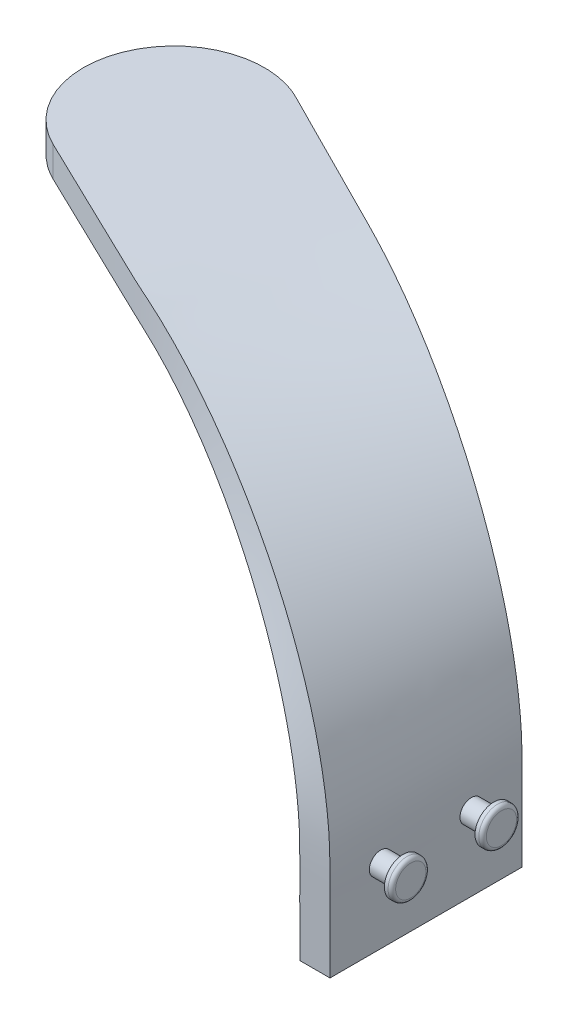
SolidWorks part; units mm, degrees
other "<Strap_right_&>-<Fillet1>"
ref_plane "Front Plane" through (0, 0, 0) normal (0, 0, 1) x (1, 0, 0)
ref_plane "Top Plane" through (0, 0, 0) normal (0, 1, 0) x (1, 0, 0)
ref_plane "Right Plane" through (0, 0, 0) normal (1, 0, 0) x (0, 0, -1)
mirrored part "Strap_right_&_Mirrored"
